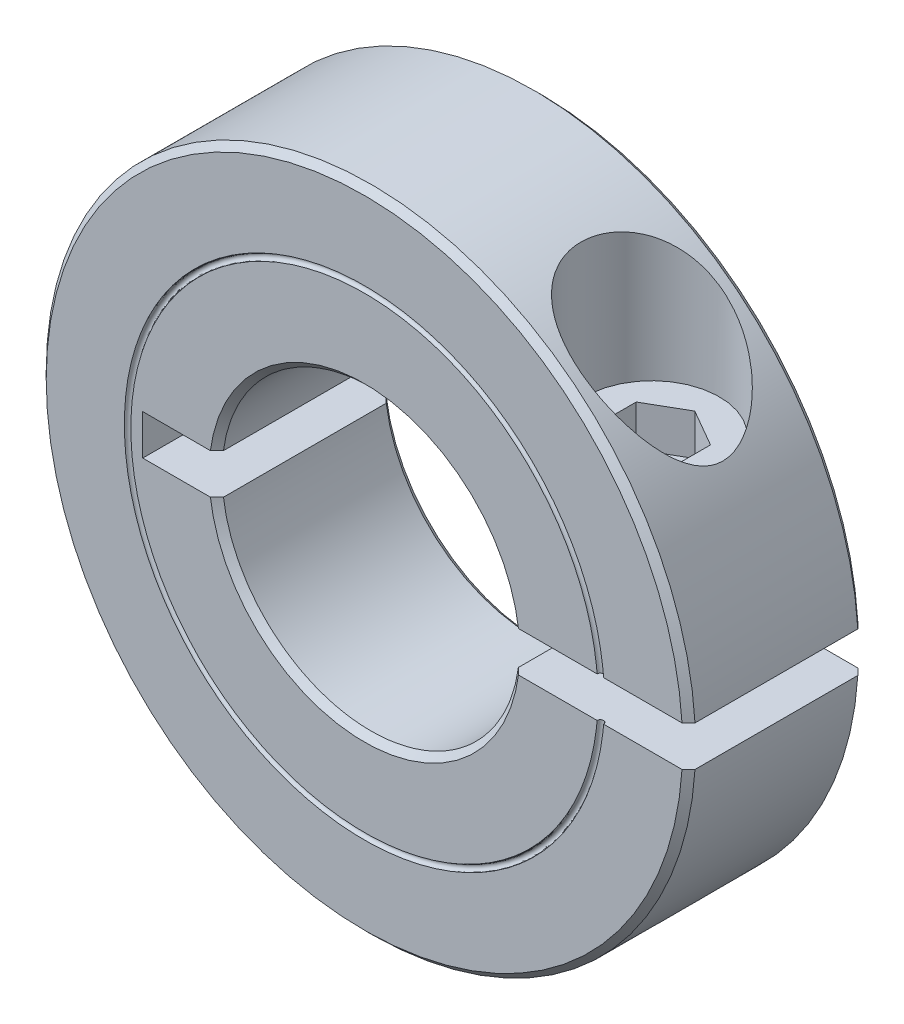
SolidWorks part; units mm, degrees
other "LUMP1"
ref_plane "Front" through (0, 0, 0) normal (0, 0, 1) x (1, 0, 0)
ref_plane "Top" through (0, 0, 0) normal (0, 1, 0) x (1, 0, 0)
ref_plane "Right" through (0, 0, 0) normal (1, 0, 0) x (0, 0, -1)
imported_body "Imported1"
move or copy body "Body-Move/Copy1" bodies to move or copy 101 placed by mates yes
ref_plane "Z Location" through (0, 0, 33.0429) normal (0, 0, 1) x (1, 0, 0)
sketch "Y Location" plane through (0, 0, 33.0429) normal (0, 0, 1) x (1, 0, 0)
  line L0 (0, 0) -> (0, 83.4949) construction
  dimension "BD71" = 83.4949
move or copy body "Body-Move/Copy2" bodies to move or copy 101 placed by mates yes
other "Distance1" parameters "D1"=5.1562
